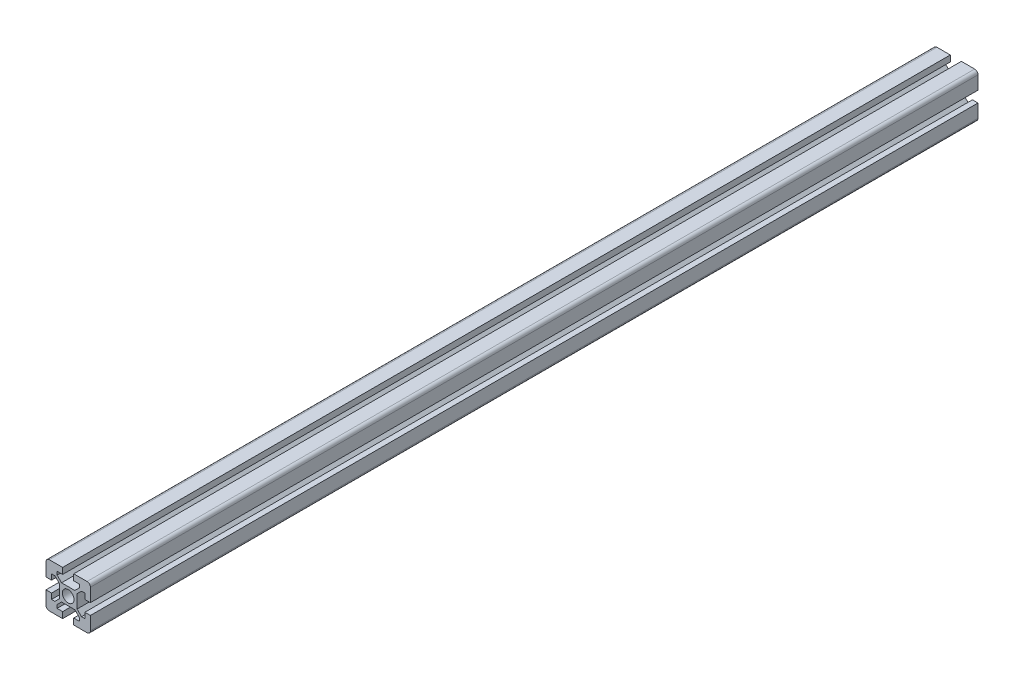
SolidWorks part; units mm, degrees
ref_plane "前基準面" through (0, 0, 0) normal (0, 0, 1) x (1, 0, 0)
ref_plane "上基準面" through (0, 0, 0) normal (0, 1, 0) x (1, 0, 0)
ref_plane "右基準面" through (0, 0, 0) normal (1, 0, 0) x (0, 0, -1)
sketch "草圖1" plane through (0, 0, 0) normal (0, 0, 1) x (1, 0, 0)
  line L0 (15, -5.5) -> (10, -5.5)
  line L1 (3, 0) -> (15, 0)
  line L2 (0, -3) -> (0, -15)
  line L3 (3, -40) -> (15, -40)
  line L4 (40, -3) -> (40, -15)
  line L5 (24.67, -40) -> (37, -40)
  line L6 (15, 0) -> (15, -5.5)
  line L7 (25, 0) -> (37, 0)
  line L8 (25, 0) -> (25, -5.5)
  line L9 (10, -5.5) -> (10, -8.5)
  line L10 (10, -8.5) -> (14, -12.5)
  line L11 (14, -12.5) -> (26, -12.5)
  line L12 (26, -12.5) -> (30, -8.5)
  line L13 (30, -8.5) -> (30, -5.5)
  line L14 (30, -5.5) -> (25, -5.5)
  line L17 (0, -25) -> (0, -37)
  line L18 (30, -34.5) -> (25, -34.5)
  line L19 (30, -31.5) -> (30, -34.5)
  line L20 (26, -27.5) -> (30, -31.5)
  line L21 (14, -27.5) -> (26, -27.5)
  line L22 (10, -31.5) -> (14, -27.5)
  line L23 (10, -34.5) -> (10, -31.5)
  line L24 (25, -40) -> (25, -34.5)
  line L25 (5, -15) -> (5, -10)
  line L26 (0, -15) -> (5, -15)
  line L27 (15, -40) -> (15, -34.5)
  line L28 (0, -25) -> (5, -25)
  line L29 (15, -34.5) -> (10, -34.5)
  line L30 (5, -10) -> (8, -10)
  line L31 (8, -10) -> (12, -14)
  line L32 (12, -14) -> (12, -26)
  line L33 (12, -26) -> (8, -30)
  line L34 (8, -30) -> (5, -30)
  line L35 (5, -30) -> (5, -25)
  line L36 (35, -30) -> (35, -25)
  line L37 (32, -30) -> (35, -30)
  line L38 (28, -26) -> (32, -30)
  line L39 (28, -14) -> (28, -26)
  line L40 (32, -10) -> (28, -14)
  line L41 (35, -10) -> (32, -10)
  line L42 (40, -25) -> (35, -25)
  line L43 (40, -15) -> (35, -15)
  line L44 (35, -15) -> (35, -10)
  line L45 (40, -25) -> (40, -37)
  circle A0 centre (20, -20) radius 5.25
  arc A1 (37, -40) -> (40, -37) centre (37, -37) ccw
  arc A2 (0, -37) -> (3, -40) centre (3, -37) ccw
  arc A3 (37, 0) -> (40, -3) centre (37, -3) cw
  arc A4 (3, 0) -> (0, -3) centre (3, -3) ccw
  point P52 (0, -40)
  point P55 (40, 0)
  point P58 (0, 0)
  dimension "D23" = 10.5
  dimension "D26" = 3
  dimension "D1" = 40
  dimension "D2" = 40
  dimension "D3" = 10
  dimension "D4" = 20
  dimension "D5" = 5
  dimension "D6" = 7
  dimension "D7" = 7
  dimension "D8" = 5.5
  dimension "D9" = 12
  dimension "D10" = 4
  dimension "D11" = 4
  dimension "D12" = 20
  dimension "D13" = 10
  dimension "D14" = 5
  dimension "D15" = 5
  dimension "D16" = 7
  dimension "D17" = 12
  dimension "D18" = 4
  dimension "D19" = 3
  dimension "D20" = 3
  dimension "D21" = 15
  dimension "D22" = 15
  dimension "D24" = 20
  dimension "D25" = 20
extrude "填料-伸長1" add sketch "草圖1" along normal blind 800 contours L1 A4 L2 L26 L25 L30 L31 L32 L33 L34 L35 L28 L17 A2 L3 L27 L29 L23 L22 L21 L20 L19 L18 L24 L5 A1 L45 L42 L36 L37 L38 L39 L40 L41 L44 L43 L4 A3 L7 L8 L14 L13 L12 L11 L10 L9 L0 L6 A0
